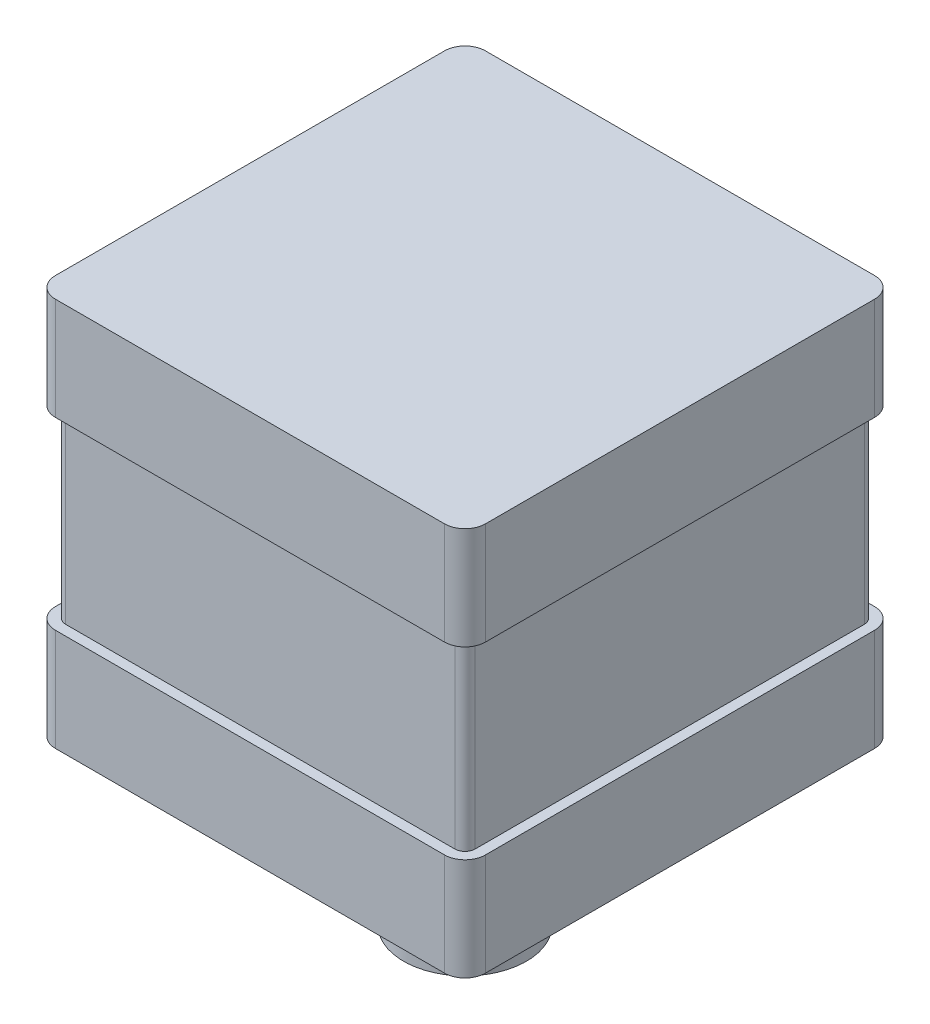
SolidWorks part; units mm, degrees
ref_plane "前视基准面" through (0, 0, 0) normal (0, 0, 1) x (1, 0, 0)
ref_plane "上视基准面" through (0, 0, 0) normal (0, 1, 0) x (1, 0, 0)
ref_plane "右视基准面" through (0, 0, 0) normal (1, 0, 0) x (0, 0, -1)
other "Configuration Table"
sketch "草图1" plane through (0, 0, 0) normal (0, 1, 0) x (1, 0, 0)
  line L1 (-19, -21) -> (19, -21)
  line L2 (-21, -19) -> (-21, 19)
  line L3 (-19, 21) -> (19, 21)
  line L4 (21, -19) -> (21, 19)
  line L5 (-21, -21) -> (21, 21) construction
  line L6 (-21, 21) -> (21, -21) construction
  arc A0 (-21, 19) -> (-19, 21) centre (-19, 19) cw
  arc A1 (21, 19) -> (19, 21) centre (19, 19) ccw
  arc A2 (-19, -21) -> (-21, -19) centre (-19, -19) cw
  arc A3 (19, -21) -> (21, -19) centre (19, -19) ccw
  point P0 (0, 0)
  dimension "D1" = 2
  dimension "D2" = 2
  dimension "D3" = 2
  dimension "D4" = 2
extrude "凸台-拉伸1" add sketch "草图1" along normal blind 10
sketch "草图2" plane through (0, 0, 0) normal (0, -1, 0) x (1, 0, 0)
  line L1 (-19, -20) -> (19, -20)
  line L2 (-20, -19) -> (-20, 19)
  line L3 (-19, 20) -> (19, 20)
  line L4 (20, -19) -> (20, 19)
  line L5 (-20, -20) -> (20, 20) construction
  line L6 (-20, 20) -> (20, -20) construction
  arc A0 (-20, 19) -> (-19, 20) centre (-19, 19) cw
  arc A1 (20, 19) -> (19, 20) centre (19, 19) ccw
  arc A2 (19, -20) -> (20, -19) centre (19, -19) ccw
  arc A3 (-19, -20) -> (-20, -19) centre (-19, -19) cw
  point P0 (0, 0)
  dimension "D1" = 1
  dimension "D2" = 1
  dimension "D3" = 1
  dimension "D4" = 1
extrude "凸台-拉伸2" add sketch "草图2" along normal blind 18
sketch "草图3" plane through (0, -18, 0) normal (0, -1, 0) x (1, 0, 0)
  line L0 (-19, 21) -> (19, 21) construction
  line L1 (-19, 21) -> (19, 21)
  line L14 (-19, -21) -> (19, -21)
  line L15 (21, -19) -> (21, 19)
  line L16 (19, 21) -> (-19, 21)
  line L17 (-21, 19) -> (-21, -19)
  line L18 (-19, -21) -> (19, -21)
  line L19 (21, -19) -> (21, 19)
  line L20 (19, 21) -> (-19, 21)
  line L21 (-21, 19) -> (-21, -19)
  arc A13 (-21, -19) -> (-19, -21) centre (-19, -19) ccw
  arc A14 (19, -21) -> (21, -19) centre (19, -19) ccw
  arc A15 (21, 19) -> (19, 21) centre (19, 19) ccw
  arc A16 (-19, 21) -> (-21, 19) centre (-19, 19) ccw
  arc A17 (-21, -19) -> (-19, -21) centre (-19, -19) ccw
  arc A18 (19, -21) -> (21, -19) centre (19, -19) ccw
  arc A19 (21, 19) -> (19, 21) centre (19, 19) ccw
  arc A20 (-19, 21) -> (-21, 19) centre (-19, 19) ccw
  dimension "D2" = 0
extrude "凸台-拉伸3" add sketch "草图3" along normal blind 10 contours L21 A17 L18 A18 L19 A19 L20 A20
sketch "草图4" plane through (0, -28, 0) normal (0, -1, 0) x (1, 0, 0)
  circle A0 centre (0, 0) radius 3
extrude "凸台-拉伸4" add sketch "草图4" along normal blind 15
sketch "草图5" plane through (0, -43, 0) normal (0, -1, 0) x (1, 0, 0)
  circle A0 centre (0, 0) radius 6
extrude "凸台-拉伸6" add sketch "草图5" along normal blind 1
sketch "草图6" plane through (0, -43, 0) normal (0, 1, 0) x (1, 0, 0)
  circle A0 centre (0, 0) radius 5
extrude "凸台-拉伸8" add sketch "草图6" along normal blind 4
sketch "草图7" plane through (0, -39, 0) normal (0, 1, 0) x (1, 0, 0)
  circle A0 centre (0, 0) radius 6
extrude "凸台-拉伸9" add sketch "草图7" along normal blind 1
